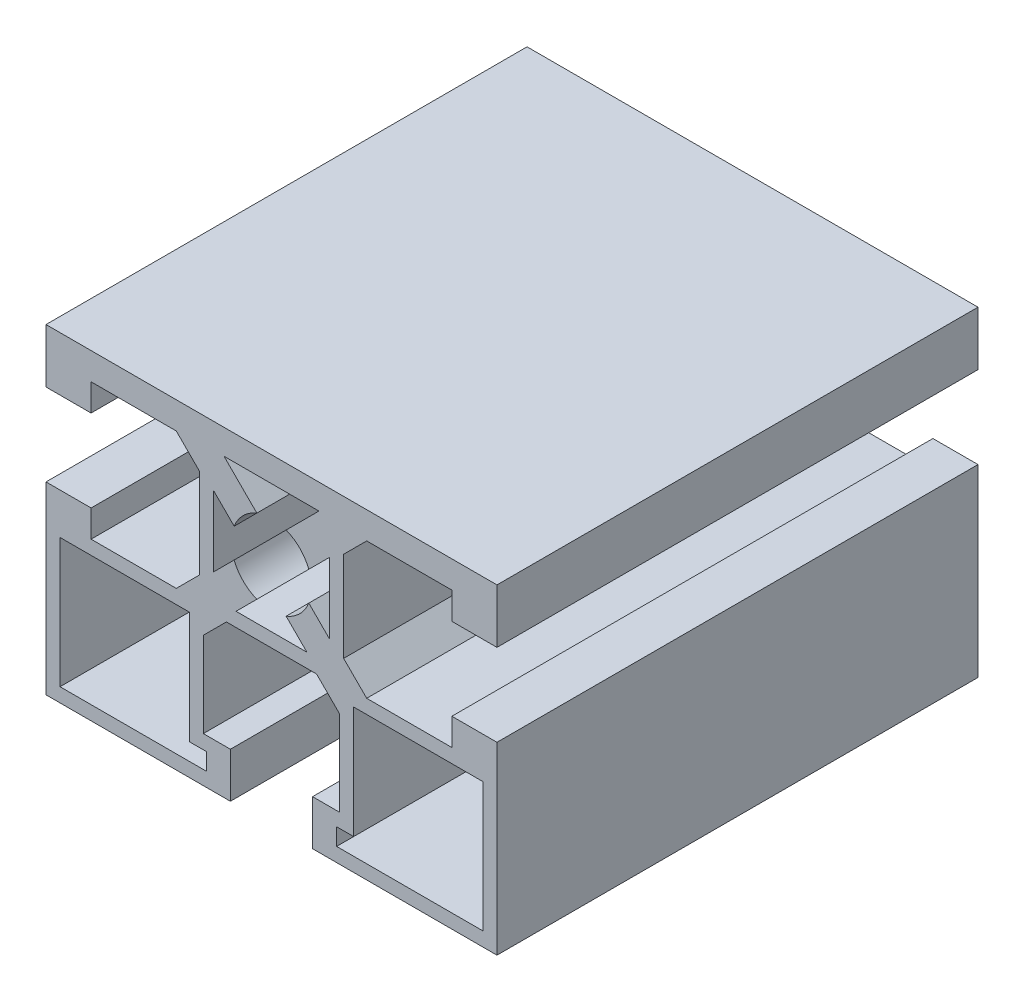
SolidWorks part; units mm, degrees
ref_plane "Front Plane" through (0, 0, 0) normal (0, 0, 1) x (1, 0, 0)
ref_plane "Top Plane" through (0, 0, 0) normal (0, 1, 0) x (1, 0, 0)
ref_plane "Right Plane" through (0, 0, 0) normal (1, 0, 0) x (0, 0, -1)
sketch "Sketch1" plane through (0, 0, 0) normal (0, 0, 1) x (1, 0, 0)
  line L5 (-8.2, -19.4) -> (-6.5, -19.4)
  line L6 (-6.5, -19.4) -> (-6.5, -21.1)
  line L7 (-6.5, -21.1) -> (-21.1, -21.1)
  line L8 (-21.1, -21.1) -> (-21.1, -8.2)
  line L9 (-21.1, -8.2) -> (-8.2, -8.2)
  line L10 (-8.2, -8.2) -> (-8.2, -19.4)
  line L16 (6.5, -19.4) -> (8.2, -19.4)
  line L17 (6.5, -21.1) -> (6.5, -19.4)
  line L18 (21.1, -21.1) -> (6.5, -21.1)
  line L19 (21.1, -8.2) -> (21.1, -21.1)
  line L20 (8.2, -8.2) -> (21.1, -8.2)
  line L21 (8.2, -19.4) -> (8.2, -8.2)
  line L68 (-22.5, 9.5) -> (-22.5, 4.1)
  line L69 (-22.5, 4.1) -> (-18, 4.1)
  line L70 (-18, 4.1) -> (-18, 6.8)
  line L71 (-18, 6.8) -> (-9.5, 6.8)
  line L72 (-9.5, 6.8) -> (-7.2, 4.5)
  line L73 (-7.2, 4.5) -> (-7.2, -4.5)
  line L74 (-7.2, -4.5) -> (-9.5, -6.8)
  line L75 (-9.5, -6.8) -> (-18, -6.8)
  line L76 (-18, -6.8) -> (-18, -4.1)
  line L77 (-18, -4.1) -> (-22.5, -4.1)
  line L78 (-22.5, -4.1) -> (-22.5, -22.5)
  line L79 (-22.5, -22.5) -> (-4.1, -22.5)
  line L80 (-4.1, -22.5) -> (-4.1, -18)
  line L81 (-4.1, -18) -> (-6.8, -18)
  line L82 (-6.8, -18) -> (-6.8, -9.5)
  line L83 (-6.8, -9.5) -> (-4.5, -7.2)
  line L84 (-4.5, -7.2) -> (4.5, -7.2)
  line L85 (4.5, -7.2) -> (6.8, -9.5)
  line L86 (6.8, -9.5) -> (6.8, -18)
  line L87 (6.8, -18) -> (4.1, -18)
  line L88 (4.1, -18) -> (4.1, -22.5)
  line L89 (4.1, -22.5) -> (22.5, -22.5)
  line L90 (22.5, -22.5) -> (22.5, -4.1)
  line L91 (22.5, -4.1) -> (18, -4.1)
  line L92 (18, -4.1) -> (18, -6.8)
  line L93 (18, -6.8) -> (9.5, -6.8)
  line L94 (9.5, -6.8) -> (7.2, -4.5)
  line L95 (7.2, -4.5) -> (7.2, 4.5)
  line L96 (7.2, 4.5) -> (9.5, 6.8)
  line L97 (9.5, 6.8) -> (18, 6.8)
  line L98 (18, 6.8) -> (18, 4.1)
  line L99 (18, 4.1) -> (22.5, 4.1)
  line L100 (22.5, 4.1) -> (22.5, 9.5)
  line L101 (22.5, 9.5) -> (-22.5, 9.5)
  line L102 (-3.4511, -1.1884) -> (-5.8, -3.5373)
  line L103 (-3.5373, -5.8) -> (-1.1884, -3.4511)
  line L104 (3.5373, -5.8) -> (-3.5373, -5.8)
  line L105 (1.1884, -3.4511) -> (3.5373, -5.8)
  line L106 (5.8, -3.5373) -> (3.4511, -1.1884)
  line L107 (5.8, 3.5373) -> (5.8, -3.5373)
  line L108 (3.4511, 1.1884) -> (5.8, 3.5373)
  line L109 (4.7373, 7) -> (1.1884, 3.4511)
  line L110 (-4.7373, 7) -> (4.7373, 7)
  line L111 (-1.1884, 3.4511) -> (-4.7373, 7)
  line L112 (-5.8, 3.5373) -> (-3.4511, 1.1884)
  line L113 (-5.8, -3.5373) -> (-5.8, 3.5373)
  arc A4 (-3.4511, -1.1884) -> (-1.1884, -3.4511) centre (0, 0) ccw
  arc A5 (1.1884, -3.4511) -> (3.4511, -1.1884) centre (0, 0) ccw
  arc A6 (3.4511, 1.1884) -> (1.1884, 3.4511) centre (0, 0) ccw
  arc A7 (-1.1884, 3.4511) -> (-3.4511, 1.1884) centre (0, 0) ccw
extrude "Extrude1" add sketch "Sketch1" along normal blind 48
sketch "Sketch2" plane through (0, 0, 48) normal (0, 0, 1) x (1, 0, 0)
  arc A0 (-1.1884, 3.4511) -> (-3.4511, 1.1884) centre (0, 0) ccw construction
  arc A1 (-1.1884, 3.4511) -> (-3.4511, 1.1884) centre (0, 0) ccw
  circle A2 centre (0, 0) radius 4.0005
  dimension "D1" = 8.001
extrude "Extrude2" cut sketch "Sketch2" against normal through all
